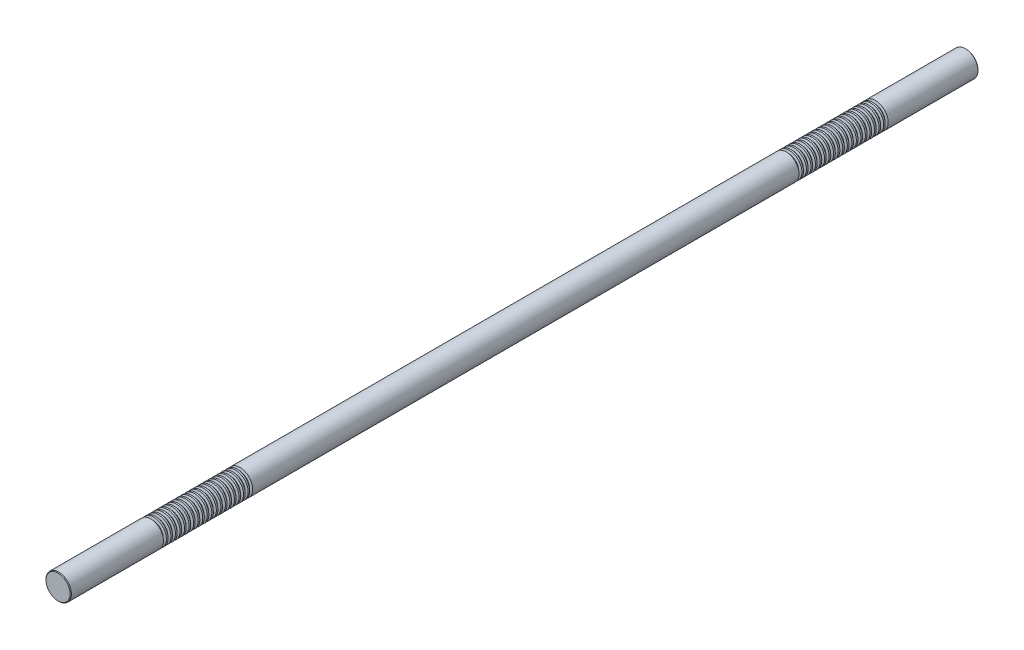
SolidWorks part; units mm, degrees
ref_plane "Front Plane" through (0, 0, 0) normal (0, 0, 1) x (1, 0, 0)
ref_plane "Top Plane" through (0, 0, 0) normal (0, 1, 0) x (1, 0, 0)
ref_plane "Right Plane" through (0, 0, 0) normal (1, 0, 0) x (0, 0, -1)
sketch "Sketch1" plane through (0, 0, 0) normal (0, 0, 1) x (1, 0, 0)
  circle A0 centre (0, 0) radius 14
  dimension "D1" = 28
extrude "Boss-Extrude1" add sketch "Sketch1" along normal mid plane 1000
chamfer "Chamfer1" distance 0.7 angle 45 2 edges at (14, 0, -500) (14, 0, 500)
sketch "Sketch2" plane through (0, 0, 0) normal (1, 0, 0) x (0, 0, -1)
  line L0 (400.3684, 14) -> (397.1316, 14)
  line L1 (499.3, 14) -> (-499.3, 14) construction
  line L2 (397.1316, 14) -> (397.8684, 11.25)
  line L3 (397.8684, 11.25) -> (399.6316, 11.25)
  line L4 (399.6316, 11.25) -> (400.3684, 14)
  line L5 (500, -13.3) -> (500, 13.3) construction
  point P4 (398.75, 14)
  point P7 (398.75, 11.25)
  point P8 (400, 12.625)
  point P9 (397.5, 12.625)
  dimension "D1" = 2.5
  dimension "D2" = 100
  dimension "D3" = 2.75
  dimension "D4" = 30
revolve "Cut-Revolve1" cut sketch "Sketch2" angle 360 about axis through (0, 0, 500) along (0, 0, -1)
pattern_linear "LPattern1" count 20 spacing 5 along (0, 0, 1) of "Cut-Revolve1"
pattern_linear "LPattern2" count 2 spacing 700 along (0, 0, 1) of "Cut-Revolve1", "LPattern1"
